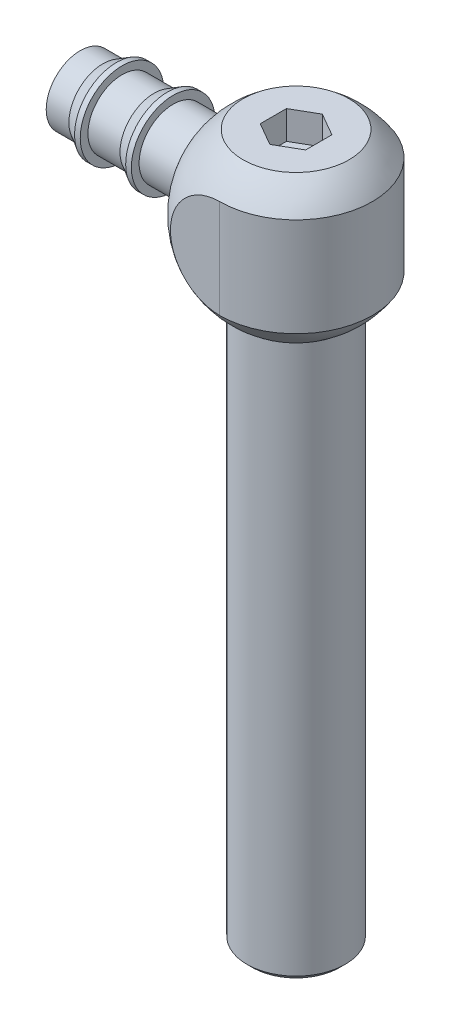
SolidWorks part; units mm, degrees
ref_plane "Front Plane" through (0, 0, 0) normal (0, 0, 1) x (1, 0, 0)
ref_plane "Top Plane" through (0, 0, 0) normal (0, 1, 0) x (1, 0, 0)
ref_plane "Right Plane" through (0, 0, 0) normal (1, 0, 0) x (0, 0, -1)
ref_plane "Plane1" through (0, 15.9829, 0) normal (0, 1, 0) x (-1, 0, 0)
sketch "Sketch1" plane through (0, 0, 0) normal (0, 0, 1) x (1, 0, 0)
  line L0 (0, 0) -> (0, 50000) construction
  line L1 (0, 28.6829) -> (0, 3.2829)
  line L2 (55, 15.9829) -> (-55, 15.9829) construction
  arc A1 (0, 3.2829) -> (0, 28.6829) centre (0, 15.9829) ccw
  dimension "D1" = 25.4
revolve "Revolve1" add sketch "Sketch1" angle 360 about L0
sketch "Sketch3" plane through (0, 0, 0) normal (0, 1, 0) x (1, 0, 0)
  line L0 (2.5806, 0) -> (50002.5806, 0) construction
  line L1 (0, -10.668) -> (-10.668, -10.668)
  line L2 (-10.668, -10.668) -> (-10.668, 10.668)
  line L3 (0, 10.668) -> (-10.668, 10.668)
  circle A0 centre (0, 0) radius 10.668 construction
  arc A1 (0, -10.668) -> (0, 10.668) centre (0, 0) ccw
  point P12 (-10.668, 0)
  dimension "D1" = 21.336
extrude "Cut-Extrude1" cut sketch "Sketch3" against normal through all and the other way through all flip side to cut
sketch "Sketch4" plane through (0, 0, 0) normal (0, 0, 1) x (1, 0, 0)
  line L0 (0, 0) -> (0, 50000) construction
  line L1 (-19.05, 26.3017) -> (19.05, 26.3017)
  line L2 (-19.05, 26.3017) -> (-19.05, 5.6642)
  line L3 (-19.05, 5.6642) -> (19.05, 5.6642)
  line L4 (19.05, 26.3017) -> (19.05, 5.6642)
  line L5 (0, 9.0921) -> (0, 22.8738) construction
  line L6 (0, 15.9829) -> (50000, 15.9829) construction
  line L7 (11.7348, 15.9829) -> (-11.7348, 15.9829) construction
  point P8 (0, 15.9829)
  dimension "D1" = 20.6375
  dimension "D2" = 38.1
extrude "Cut-Extrude2" cut sketch "Sketch4" against normal through all and the other way through all flip side to cut
sketch "Sketch9" plane through (0, 15.9829, 0) normal (0, 1, 0) x (1, 0, 0)
  line L0 (0, 0) -> (50000, 0) construction
  line L1 (-30.1625, 0) -> (-30.1625, 4.7625)
  line L2 (-30.1625, 4.7625) -> (-26.9875, 4.7625)
  line L3 (-26.9875, 4.7625) -> (-25.1178, 5.842)
  line L4 (-25.1178, 5.842) -> (-24.324, 5.842)
  line L5 (-24.324, 5.842) -> (-24.324, 4.7625)
  line L6 (-24.324, 4.7625) -> (-19.8438, 4.7625)
  line L7 (-19.8438, 4.7625) -> (-17.974, 5.842)
  line L8 (-17.974, 5.842) -> (-17.1803, 5.842)
  line L9 (-17.1803, 5.842) -> (-17.1803, 4.7625)
  line L10 (-17.1803, 4.7625) -> (0, 4.7625)
  line L11 (0, 4.7625) -> (0, 0)
  line L12 (-30.1625, 0) -> (0, 0)
  line L13 (0, 0) -> (0, 50000) construction
  dimension "D1" = 9.525
  dimension "D2" = 1.0795
  dimension "D4" = 19.8438
  dimension "D5" = 3.175
  dimension "D6" = 30.1625
  dimension "D7" = 0.7937
  dimension "D8" = 30
revolve "Revolve2" add sketch "Sketch9" angle 360 about L0
fillet "Fillet1" radius 1.1906 1 edges at (-10.668, 15.9829, -4.7625)
sketch "Sketch10" plane through (-30.1625, 0, 0) normal (-1, 0, 0) x (0, 0, 1)
  circle A0 centre (0, 15.9829) radius 3.4925
  circle A1 centre (0, 15.9829) radius 4.7625 construction
  dimension "D1" = 1.27
extrude "Cut-Extrude3" cut sketch "Sketch10" against normal up to surface (30.1625 mm away)
sketch "Sketch16" plane through (0, 0, 0) normal (0, 0, 1) x (1, 0, 0)
  line L0 (0, -23.6775) -> (0, -50023.6775) construction
  line L1 (-7.4036, 5.6642) -> (7.4036, 5.6642) construction
  line L6 (0, 5.6642) -> (6.858, 5.6642)
  line L7 (6.858, 2.4892) -> (6.858, 5.6642)
  line L8 (6.858, -71.3613) -> (6.858, 2.4892)
  line L9 (6.096, -72.1233) -> (6.858, -71.3613)
  line L10 (0, -72.1233) -> (6.096, -72.1233)
  line L11 (0, 5.6642) -> (0, -72.1233)
  dimension "D1" = 13.716
  dimension "D2" = 3.175
  dimension "D3" = 77.7875
  dimension "D4" = 0
  dimension "D5" = 45
  dimension "D6" = 0.762
revolve "Revolve3" add sketch "Sketch16" angle 360 about L0
sketch "Sketch17" plane through (0, 26.3017, 0) normal (0, 1, 0) x (1, 0, 0)
  line L0 (0, 3.4925) -> (0, -3.4925) construction
  line L1 (3.175, 1.8331) -> (0, 3.6662)
  line L2 (0, 3.6662) -> (-3.175, 1.8331)
  line L3 (-3.175, 1.8331) -> (-3.175, -1.8331)
  line L4 (-3.175, -1.8331) -> (0, -3.6662)
  line L5 (0, -3.6662) -> (3.175, -1.8331)
  line L6 (3.175, -1.8331) -> (3.175, 1.8331)
  line L7 (0, -11.3506) -> (0, 11.3506) construction
  circle A0 centre (0, 0) radius 3.175 construction
  dimension "D1" = 6.35
extrude "Cut-Extrude4" cut sketch "Sketch17" against normal blind 3.9688
sketch "Sketch18" plane through (0, -72.1233, 0) normal (0, -1, 0) x (1, 0, 0)
  circle A1 centre (0, 0) radius 4.7625
  circle A2 centre (0, 0) radius 6.858 construction
  dimension "D1" = 9.525
extrude "Cut-Extrude5" cut sketch "Sketch18" against normal blind 91.5987
